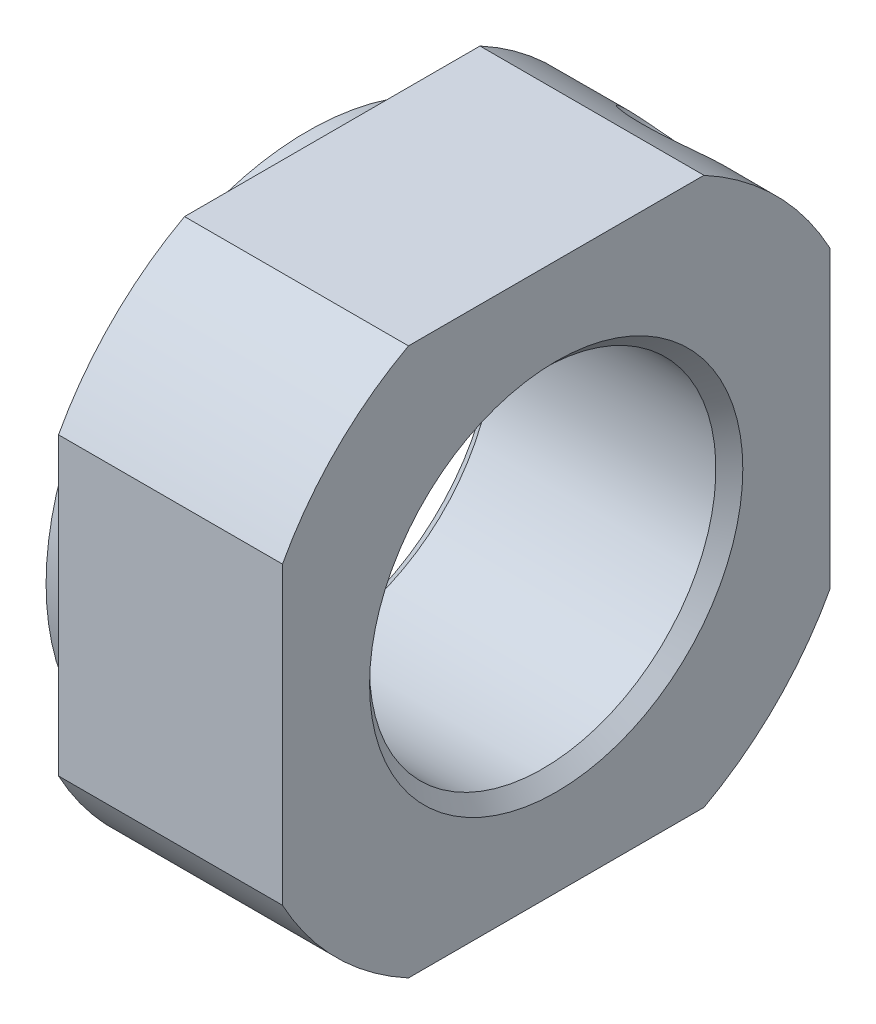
SolidWorks part; units mm, degrees
ref_plane "Front X-Y" through (0, 0, 0) normal (0, 0, 1) x (1, 0, 0)
ref_plane "Top X-Z" through (0, 0, 0) normal (0, 1, 0) x (1, 0, 0)
ref_plane "Right Y-Z" through (0, 0, 0) normal (1, 0, 0) x (0, 0, -1)
ref_plane "Plane1" through (0, 0, 0) normal (1, 0, 0) x (0, 0, -1)
sketch "Sketch1" plane through (0, 0, 0) normal (1, 0, 0) x (0, 0, -1)
  line L0 (-5.9372, -11) -> (5.9372, -11)
  line L1 (11, -5.9372) -> (11, 5.9372)
  line L2 (5.9372, 11) -> (-5.9372, 11)
  line L3 (-11, 5.9372) -> (-11, -5.9372)
  arc A0 (-11, -5.9372) -> (-5.9372, -11) centre (0, 0) ccw
  arc A1 (5.9372, -11) -> (11, -5.9372) centre (0, 0) ccw
  arc A2 (11, 5.9372) -> (5.9372, 11) centre (0, 0) ccw
  arc A3 (-5.9372, 11) -> (-11, 5.9372) centre (0, 0) ccw
extrude "Boss-Extrude1" add sketch "Sketch1" along normal blind 9
ref_plane "Plane2" through (0, 0, 0) normal (0, 0, 1) x (1, 0, 0)
sketch "Sketch2" plane through (0, 0, 0) normal (0, 0, 1) x (1, 0, 0)
  line L0 (-1, 0) -> (-1, 10.5)
  line L1 (-1, 10.5) -> (0, 10.5)
  line L2 (0, 10.5) -> (0, 0)
  line L3 (0, 0) -> (-1, 0)
  line L4 (0, 0) -> (-1, 0) construction
revolve "Revolve1" add sketch "Sketch2" angle 360 about L4
ref_plane "Plane3" through (0, 0, 0) normal (0, 0, 1) x (1, 0, 0)
sketch "Sketch3" plane through (0, 0, 0) normal (0, 0, 1) x (1, 0, 0)
  line L0 (-1, 0) -> (-1, 7.5)
  line L1 (-1, 7.5) -> (-0.4585, 6.9585)
  line L2 (-0.4585, 6.9585) -> (8.4585, 6.9585)
  line L3 (8.4585, 6.9585) -> (9, 7.5)
  line L4 (9, 7.5) -> (9, 0)
  line L5 (9, 0) -> (-1, 0)
  line L6 (9, 0) -> (-1, 0) construction
revolve "Cut-Revolve1" cut sketch "Sketch3" angle 360 about L6
ref_plane "Plane4" through (5, 0, 0) normal (1, 0, 0) x (0, 0, -1)
sketch "Sketch4" plane through (5, 0, 0) normal (1, 0, 0) x (0, 0, -1)
  line L0 (8.8388, 8.8388) -> (10.253, 7.4246)
  line L1 (10.253, 7.4246) -> (9.7171, 7.4246)
  line L2 (9.7171, 7.4246) -> (1.1462, -1.1462)
  line L3 (1.1462, -1.1462) -> (0, 0)
  line L4 (0, 0) -> (8.8388, 8.8388)
  line L5 (0, 0) -> (8.8388, 8.8388) construction
revolve "Cut-Revolve2" cut sketch "Sketch4" angle 360 about L5
